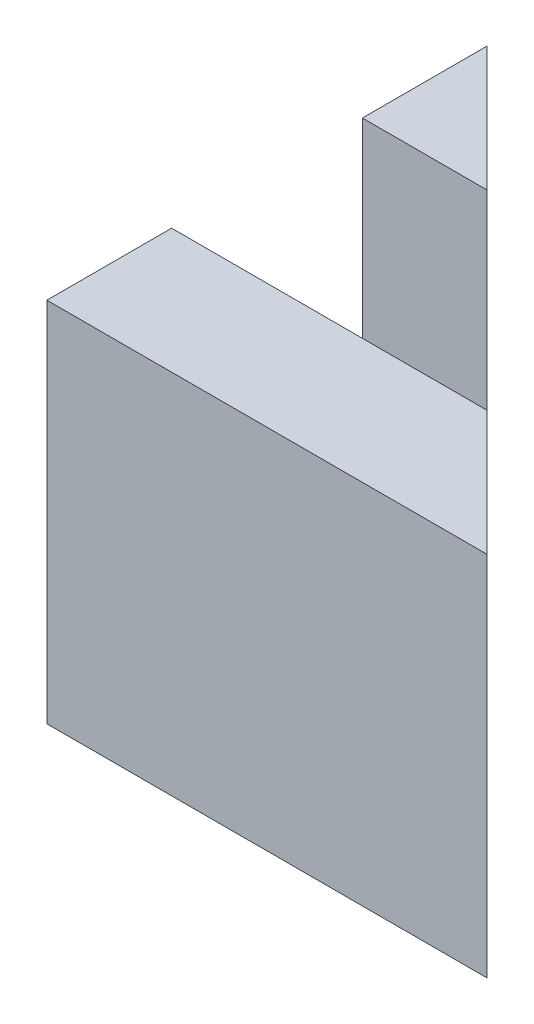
SolidWorks part; units mm, degrees
ref_plane "Face" through (0, 0, 0) normal (0, 0, 1) x (1, 0, 0)
ref_plane "Dessus" through (0, 0, 0) normal (0, 1, 0) x (1, 0, 0)
ref_plane "Droite" through (0, 0, 0) normal (1, 0, 0) x (0, 0, -1)
sketch "Esquisse1" plane through (0, 0, 0) normal (1, 0, 0) x (0, 0, -1)
  line L0 (-6.3934, 0) -> (65.9739, 0) construction
  line L1 (0, -8.3606) -> (0, 56.0651) construction
  line L2 (-6.3934, 25) -> (65.9739, 25) construction
  line L3 (30, -8.3606) -> (30, 56.0651) construction
  line L4 (15, 50.677) -> (15, -8.3606) construction
  line L5 (1.5, 31.0798) -> (1.5, -8.3606) construction
  line L6 (7, 31.0798) -> (7, -8.3606) construction
  line L7 (8.5, 31.0798) -> (8.5, -8.3606) construction
  line L8 (-1.3914, 12.5) -> (59.6308, 12.5) construction
  line L9 (-6.3934, 1.5) -> (31.1461, 1.5) construction
  line L10 (-6.3934, 7.5) -> (33.9897, 7.5) construction
  line L11 (-6.3934, 9) -> (33.9897, 9) construction
  line L12 (8.5, 9) -> (8.5, 25)
  line L13 (14.25, -8.3606) -> (14.25, 10.7738) construction
  line L14 (1.5, 16) -> (7, 16)
  line L15 (1.5, 7.5) -> (7, 7.5)
  line L16 (1.5, 7.5) -> (1.5, 1.5)
  line L17 (1.5, 1.5) -> (7, 1.5)
  line L18 (7, 7.5) -> (7, 1.5)
  line L19 (7, 17.5) -> (7, 23.5)
  line L20 (1.5, 16) -> (1.5, 9)
  line L21 (1.5, 9) -> (7, 9)
  line L22 (7, 16) -> (7, 9)
  line L23 (1.5, 23.5) -> (7, 23.5)
  line L24 (1.5, 17.5) -> (1.5, 23.5)
  line L25 (1.5, 17.5) -> (7, 17.5)
  line L26 (8.5, 7.5) -> (14.25, 7.5)
  line L27 (8.5, 7.5) -> (8.5, 1.5)
  line L28 (8.5, 1.5) -> (14.25, 1.5)
  line L29 (14.25, 7.5) -> (14.25, 1.5)
  line L30 (8.5, 25) -> (0, 25)
  line L31 (0, 25) -> (0, 0)
  line L32 (21.5, 25) -> (30, 25)
  line L33 (21.5, 9) -> (21.5, 25)
  line L34 (30, 25) -> (30, 0)
  line L35 (15.75, 7.5) -> (15.75, 1.5)
  line L36 (21.5, 1.5) -> (15.75, 1.5)
  line L37 (21.5, 7.5) -> (21.5, 1.5)
  line L38 (21.5, 7.5) -> (15.75, 7.5)
  line L39 (28.5, 17.5) -> (23, 17.5)
  line L40 (28.5, 17.5) -> (28.5, 23.5)
  line L41 (28.5, 23.5) -> (23, 23.5)
  line L42 (23, 16) -> (23, 9)
  line L43 (28.5, 9) -> (23, 9)
  line L44 (28.5, 16) -> (28.5, 9)
  line L45 (23, 17.5) -> (23, 23.5)
  line L46 (23, 7.5) -> (23, 1.5)
  line L47 (28.5, 1.5) -> (23, 1.5)
  line L48 (28.5, 7.5) -> (28.5, 1.5)
  line L49 (28.5, 7.5) -> (23, 7.5)
  line L50 (28.5, 16) -> (23, 16)
  line L51 (8.5, 9) -> (21.5, 9)
  line L52 (0, 0) -> (30, 0)
  dimension "D1" = 30
  dimension "D2" = 25
  dimension "D3" = 15
  dimension "D4" = 12.5
  dimension "D5" = 1.5
  dimension "D6" = 1.5
  dimension "D7" = 1.5
  dimension "D9" = 1.5
  dimension "D10" = 6
  dimension "D11" = 5.5
  dimension "D12" = 0.75
extrude "Extrusion1" add sketch "Esquisse1" along normal blind 30
draft "Dépouille1" type of draft neutral plane draft angle 1 faces to draft 32 parameters "D1"=1
sketch "Esquisse2" plane through (0, 25, 0) normal (0, 1, 0) x (-1, 0, 0)
  line L0 (1.378, -31.378) -> (-31.159, 1.159)
  line L1 (1.378, -31.378) -> (-31.159, -31.378)
  line L2 (-31.159, -31.378) -> (-31.159, 1.159)
extrude "Enlèv. mat.-Extru.1" cut sketch "Esquisse2" against normal through all
